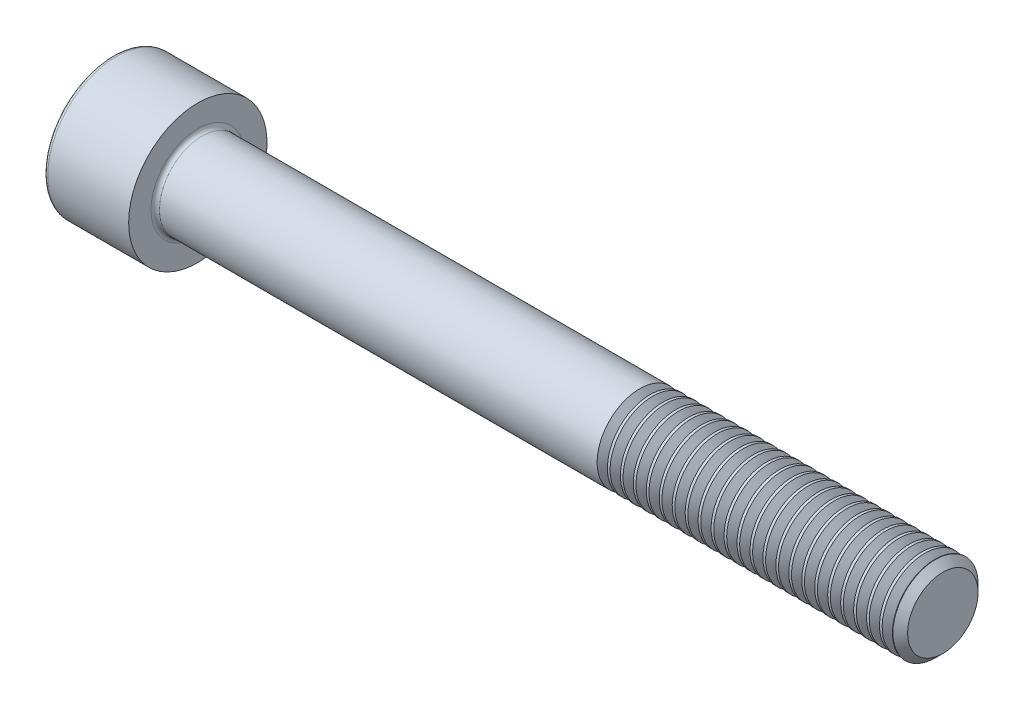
SolidWorks part; units mm, degrees
ref_plane "Plane1" through (0, 0, 0) normal (0, 0, 1) x (1, 0, 0)
ref_plane "Plane2" through (0, 0, 0) normal (0, 1, 0) x (1, 0, 0)
ref_plane "Plane3" through (0, 0, 0) normal (1, 0, 0) x (0, 0, -1)
revolve "Base-Revolve" add sketch "BodySke"
sketch "BodySke" plane through (0, 0, 0) normal (0, 0, 1) x (1, 0, 0)
  line L0 (0, 0) -> (0, 6.5)
  line L1 (0, 6.5) -> (8, 6.5)
  line L2 (8, 6.5) -> (8, 4)
  line L3 (8, 4) -> (77.3095, 4)
  line L4 (78, 3.3095) -> (78, 0)
  line L5 (78, 0) -> (0, 0)
  line L6 (-31.75, 0) -> (127, 0) construction
  line L8 (78, 3.3095) -> (77.3095, 4)
  line L10 (78, -3.3095) -> (77.3095, -4) construction
  line L11 (9.25, 2.4825) -> (9.25, -3.8675) construction
  line L12 (50, 2.4825) -> (50, -3.8675) construction
  line L13 (18, 2.4825) -> (18, -3.8675) construction
  dimension "Diameter" = 8
  dimension "Head_ht" = 8
  dimension "Length" = 70
  dimension "Body_ch_ang" = 45
  dimension "Head_dia" = 13
  dimension "Minor_dia" = 6.619
  dimension "Advance" = 1.25
  dimension "Thread_nom" = 28
  dimension "Thread_length" = 60
fillet "Fillet1" radius 0.4
fillet "Fillet2" radius 0.4
sketch "Sketch2" plane through (0, 0, 0) normal (0, 0, 1) x (1, 0, 0)
  line L0 (0, 3.0475) -> (4, 3.0475)
  line L1 (4, 3.0475) -> (5.7595, 0)
  line L2 (-31.75, 0) -> (127, 0) construction
  line L3 (5.7595, 0) -> (0, 0)
  line L4 (0, 0) -> (0, 3.0475)
  line L6 (0, 0) -> (47.625, 0) construction
  dimension "D1" = 3.0475
  dimension "D2" = 60
  dimension "Depth" = 4
revolve "Hex-PreBroach" cut sketch "Sketch2" angle 360 about L6
sketch "Sketch3" plane through (0, 0, 0) normal (-1, 0, 0) x (0, 0.5, 0.866)
  line L0 (1.7595, 3.0475) -> (-1.7595, 3.0475)
  line L1 (-1.7595, 3.0475) -> (-3.5189, 0)
  line L2 (1.7595, 3.0475) -> (3.5189, 0)
  line L3 (1.7595, -3.0475) -> (3.5189, 0)
  line L4 (1.7595, -3.0475) -> (-1.7595, -3.0475)
  line L5 (-1.7595, -3.0475) -> (-3.5189, 0)
  dimension "D1" = 3.0475
  dimension "D2" = 3.0475
  dimension "Hex_size" = 6.095
extrude "Hex" cut sketch "Sketch3" against normal blind 4
sketch "ThdSchSke" plane through (0, 0, 0) normal (0, 0, 1) x (1, 0, 0)
  line L0 (50, -3.3095) -> (49.5165, -4)
  line L1 (50, -3.3095) -> (50.4835, -4)
  line L2 (50.4835, -4) -> (50.4835, -5)
  line L3 (-3.175, 0) -> (5.1513, 0) construction
  line L4 (0, 6.1) -> (0, -6.1) construction
  line L5 (50.4835, -5) -> (49.5165, -5)
  line L6 (49.5165, -5) -> (49.5165, -4)
  dimension "Thread_minor" = 6.619
  dimension "Diameter" = 8
  dimension "Start" = 50
  dimension "SideAngle" = 55
  dimension "VeeAngle" = 70
  dimension "Overcut" = 10
revolve "ThreadSchematic" cut sketch "ThdSchSke" angle 360 about L3
pattern_linear "ThdSchPat"
equation "\"D2@Sketch3\" = \"Hex_size@Sketch3\" / 2"
equation "\"D1@Sketch3\" = \"Hex_size@Sketch3\" / 2"
equation "\"D1@Sketch2\" = \"Hex_size@Sketch3\" / 2"
equation "\"Thread_minor@ThreadCosmetic\"  =  \"Minor_dia@BodySke\""
equation "\"Depth@Sketch2\" =  \"Key_eng@Hex\""
equation "\"Thread_length@ThreadCosmetic\" = ((sgn( (\"Length@BodySke\" - \"Advance@BodySke\" * 3.0) - \"Thread_nom@BodySke\" )-1)*( (\"Length@BodySke\" - \"Advance@BodySke\" * 3.0) - \"Thread_nom@BodySke\" ))/-2+ \"Thread_no"
equation "\"Thread_minor@ThdSchSke\" = \"Minor_dia@BodySke\""
equation "\"Diameter@ThdSchSke\" = \"Diameter@BodySke\""
equation "\"Overcut@ThdSchSke\" = \"Diameter@BodySke\" * 1.25"
equation "\"Start@ThdSchSke\" = \"Head_ht@BodySke\" + \"Length@BodySke\" - \"Thread_length@ThreadCosmetic\"  '---Non-countersunk---"
equation "\"Num_threads@ThdSchPat\" = int( \"Thread_length@ThreadCosmetic\" / \"Advance@BodySke\" + 0.999 )  + 1"
equation "\"Advance@ThdSchPat\" = \"Thread_length@ThreadCosmetic\" /  (\"Num_threads@ThdSchPat\" - 1) 'relax it"
equation "\"Num_threads@ThdSchPat\" = \"Num_threads@ThdSchPat\" - sgn( \"Num_threads@ThdSchPat\" - 1) '---chamfered tips only---"
